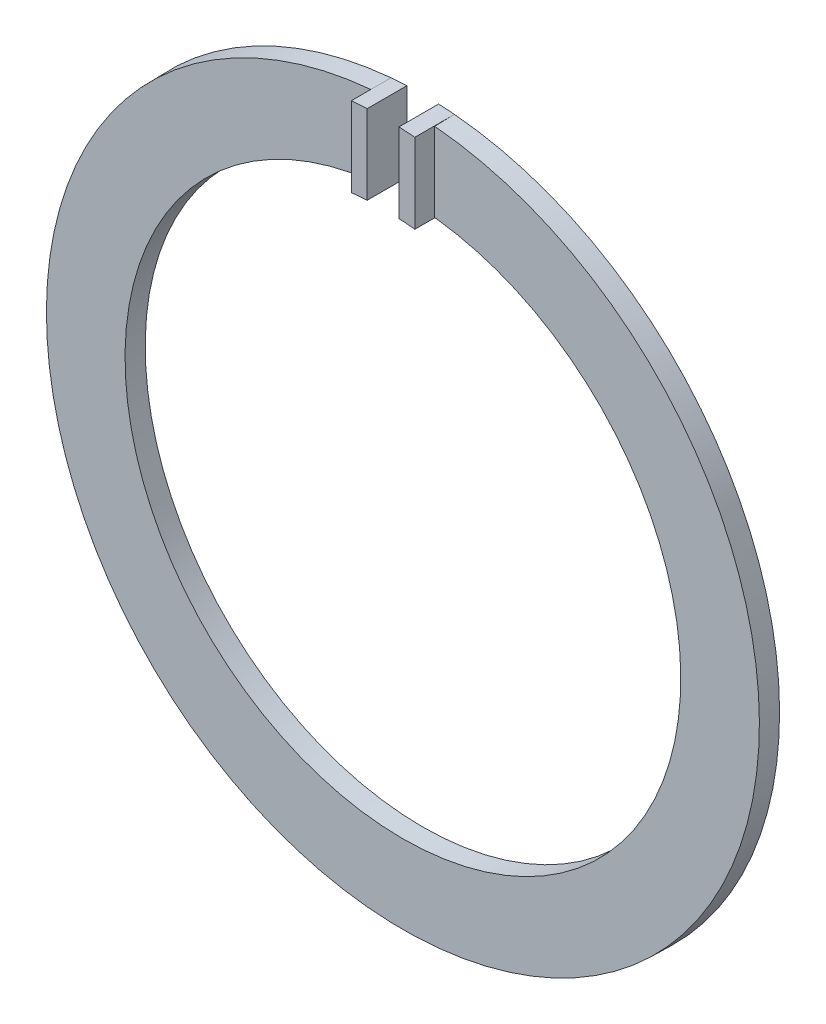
SolidWorks part; units mm, degrees
ref_plane "Front Plane" through (0, 0, 0) normal (0, 0, 1) x (1, 0, 0)
ref_plane "Top Plane" through (0, 0, 0) normal (0, 1, 0) x (1, 0, 0)
ref_plane "Right Plane" through (0, 0, 0) normal (1, 0, 0) x (0, 0, -1)
sketch "Sketch1" plane through (0, 0, 0) normal (0, 0, 1) x (1, 0, 0)
  circle A0 centre (0, 0) radius 44.45
  circle A1 centre (0, 0) radius 57.15
  dimension "D1" = 114.3
  dimension "D2" = 88.9
extrude "Boss-Extrude1" add sketch "Sketch1" along normal blind 3.175 draft 1
sketch "Sketch2" plane through (0, 0, 3.175) normal (0, 0, 1) x (1, 0, 0)
  line L0 (0, 40.7373) -> (0, 60.2853) construction
  line L1 (2.54, 40.7373) -> (2.54, 60.2853)
  line L2 (-2.54, 40.7373) -> (-2.54, 60.2853)
  line L3 (-2.54, 40.7373) -> (2.54, 40.7373)
  line L4 (-2.54, 60.2853) -> (2.54, 60.2853)
  line L5 (-2.54, 0) -> (-2.54, 60.2853) construction
  line L6 (0, 0) -> (0, 60.2853) construction
  line L7 (2.54, 0) -> (2.54, 60.2853) construction
  dimension "D1" = 2.54
  dimension "D2" = 2.54
extrude "Cut-Extrude1" cut sketch "Sketch2" against normal blind 3.175
sketch "Sketch3" plane through (0, 0, 0) normal (0, 0, -1) x (-1, 0, 0)
  line L0 (-2.54, 57.0935) -> (-2.54, 44.3774)
  line L1 (-2.54, 44.3774) -> (-2.54, 57.0935) construction
  line L2 (2.54, 44.3774) -> (2.54, 57.0935)
  line L3 (2.54, 57.0935) -> (2.54, 44.3774) construction
  line L4 (5.08, 44.1588) -> (5.08, 56.9238)
  line L5 (-5.08, 56.9238) -> (-5.08, 44.1588)
  line L6 (-5.08, 57.0935) -> (-5.08, 44.3774) construction
  line L7 (5.08, 44.3774) -> (5.08, 57.0935) construction
  arc A0 (-2.54, 57.0935) -> (2.54, 57.0935) centre (0, 0) ccw construction
  arc A1 (5.08, 44.1588) -> (2.54, 44.3774) centre (0, 0) ccw
  arc A2 (5.08, 56.9238) -> (2.54, 57.0935) centre (0, 0) ccw
  arc A3 (-2.54, 57.0935) -> (-5.08, 56.9238) centre (0, 0) ccw
  arc A4 (-2.54, 44.3774) -> (-5.08, 44.1588) centre (0, 0) ccw
  dimension "D1" = 2.54
  dimension "D2" = 2.54
extrude "Boss-Extrude2" add sketch "Sketch3" against normal blind 6.35
